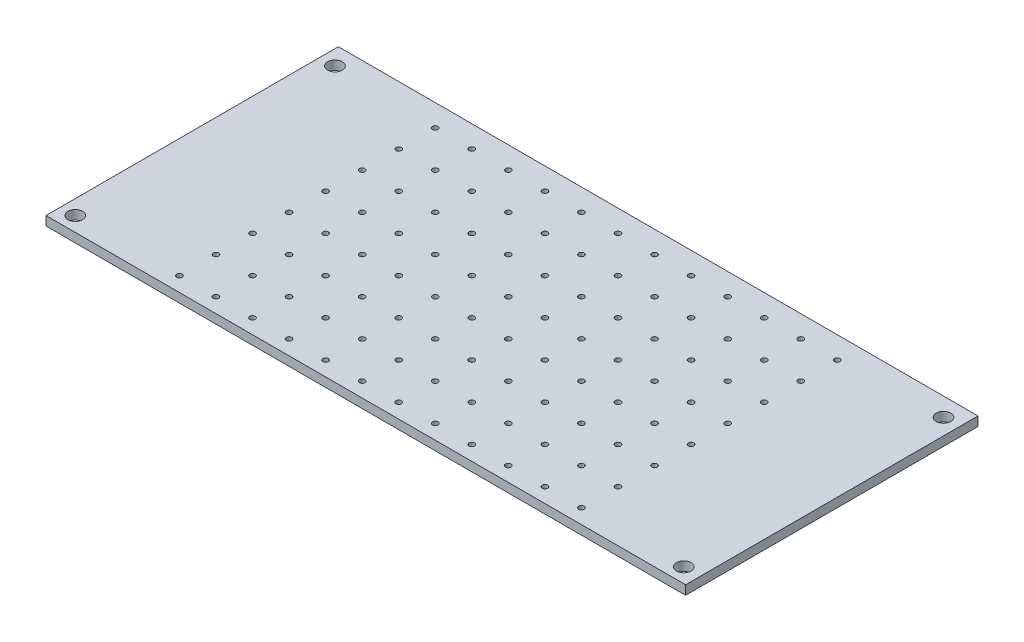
SolidWorks part; units mm, degrees
ref_plane "Alzado" through (0, 0, 0) normal (0, 0, 1) x (1, 0, 0)
ref_plane "Planta" through (0, 0, 0) normal (0, 1, 0) x (1, 0, 0)
ref_plane "Vista lateral" through (0, 0, 0) normal (1, 0, 0) x (0, 0, -1)
sketch "Croquis1" plane through (0, 0, 0) normal (0, 1, 0) x (1, 0, 0)
  line L1 (-175, -80) -> (175, -80)
  line L2 (-175, -80) -> (-175, 80)
  line L3 (-175, 80) -> (175, 80)
  line L4 (175, -80) -> (175, 80)
  line L5 (-175, -80) -> (175, 80) construction
  line L6 (-175, 80) -> (175, -80) construction
  point P0 (0, 0)
  dimension "D1" = 160
  dimension "D2" = 350
extrude "Saliente-Extruir1" add sketch "Croquis1" along normal blind 5
sketch "Croquis2" plane through (0, 5, 0) normal (0, 1, 0) x (1, 0, 0)
  line L0 (-110, 80) -> (-110, -80) construction
  line L1 (175, 80) -> (-175, 80) construction
  line L2 (-175, -80) -> (175, -80) construction
  line L3 (-175, 80) -> (-175, -80) construction
  line L4 (110, 80) -> (110, -80) construction
  line L5 (175, -80) -> (175, 80) construction
  line L6 (0, 100.7767) -> (0, -116.3899) construction
  line L7 (-186.8863, 0) -> (189.2519, 0) construction
  line L8 (-110, 68) -> (110, 68) construction
  line L9 (-110, -68) -> (110, -68) construction
  line L10 (-90, 68) -> (-90, -68) construction
  line L11 (-70, 68) -> (-70, -68) construction
  line L12 (-50, 68) -> (-50, -68) construction
  line L13 (-30, 68) -> (-30, -68) construction
  line L14 (-10, 68) -> (-10, -68) construction
  line L15 (10, 68) -> (10, -68) construction
  line L16 (30, 68) -> (30, -68) construction
  line L17 (50, 68) -> (50, -68) construction
  line L18 (70, 68) -> (70, -68) construction
  line L19 (90, 68) -> (90, -68) construction
  line L20 (110, 68) -> (110, -68) construction
  circle A0 centre (-110, 68) radius 1.5
  dimension "D6" = 3
  dimension "D1" = 65
  dimension "D2" = 65
  dimension "D3" = 12
  dimension "D4" = 20
  dimension "D5" = 11
extrude "Cortar-Extruir1" cut sketch "Croquis2" against normal blind 5
pattern_linear "MatrizL1" count 12 spacing 20 along (1, 0, 0) of "Cortar-Extruir1"
pattern_linear "MatrizL2" count 8 spacing 20 along (0, 0, 1) of "MatrizL1", "Cortar-Extruir1"
sketch "Croquis3" plane through (0, 5, 0) normal (0, 1, 0) x (1, 0, 0)
  line L0 (-175, 80) -> (-175, -80) construction
  circle A0 centre (-166.806, 69.9172) radius 4
  point P0 (-166.806, 69.9172)
  dimension "D2" = 8
  dimension "D1" = 8.194
extrude "Cortar-Extruir2" cut sketch "Croquis3" against normal blind 5
sketch "Croquis5" plane through (0, 5, 0) normal (0, 1, 0) x (1, 0, 0)
  line L0 (-175, 80) -> (-175, -80) construction
  line L1 (-175, -80) -> (175, -80) construction
  circle A0 centre (-167, -72) radius 4
  point P0 (-167, -72)
  dimension "D3" = 8
  dimension "D1" = 8
  dimension "D2" = 8
extrude "Cortar-Extruir3" cut sketch "Croquis5" against normal blind 5
sketch "Croquis6" plane through (0, 5, 0) normal (0, 1, 0) x (1, 0, 0)
  line L0 (0, 80) -> (0, -80) construction
  line L1 (175, 80) -> (-175, 80) construction
  line L2 (-175, -80) -> (175, -80) construction
pattern_linear "MatrizL3" count 2 spacing 333 along (1, 0, 0) of "Cortar-Extruir3", "Cortar-Extruir2"
